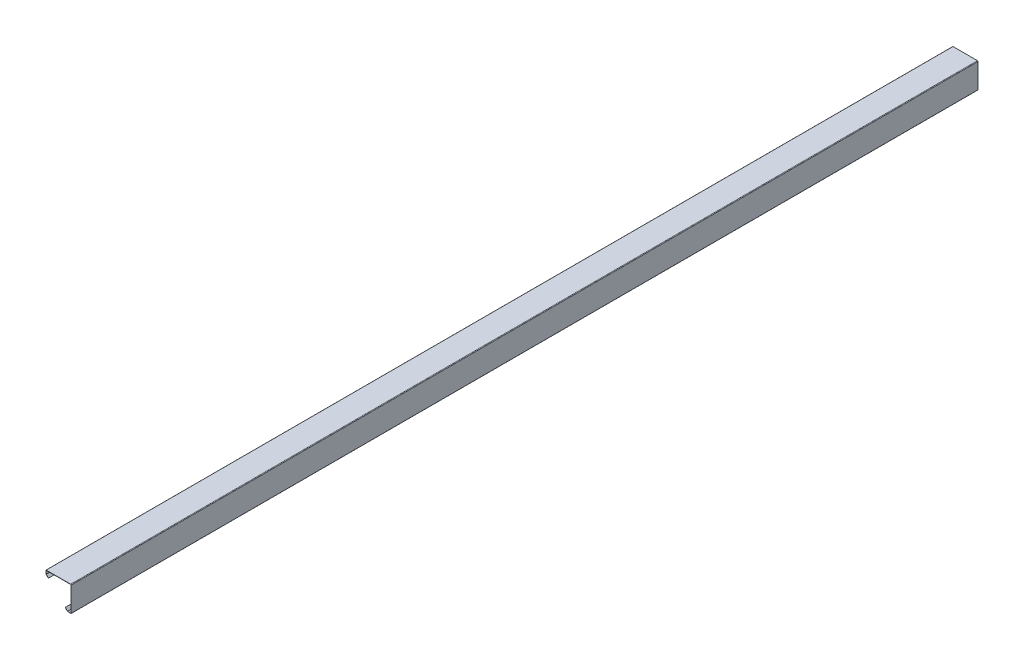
SolidWorks part; units mm, degrees
ref_plane "Front" through (0, 0, 0) normal (0, 0, 1) x (1, 0, 0)
ref_plane "Top" through (0, 0, 0) normal (0, 1, 0) x (1, 0, 0)
ref_plane "Right" through (0, 0, 0) normal (1, 0, 0) x (0, 0, -1)
sketch "Sketch1" plane through (0, 0, 0) normal (0, 0, 1) x (1, 0, 0)
  line L0 (-0.4122, -55.5625) -> (-7.9375, -55.5625)
  line L1 (-8.2289, -55.4418) -> (-13.2803, -50.3904)
  line L2 (-55.1503, 0) -> (-1.27, 0)
  line L3 (-55.4418, -8.2289) -> (-50.3904, -13.2803)
  line L4 (-55.5625, -0.4122) -> (-55.5625, -7.9375)
  line L5 (0, -55.1503) -> (0, -1.27)
  line L6 (0, 0) -> (17.4519, 17.4519) construction
  arc A0 (0, -1.27) -> (-1.27, 0) centre (-1.27, -1.27) ccw
  arc A1 (-7.9375, -55.5625) -> (-8.2289, -55.4418) centre (-7.9375, -55.1503) cw
  arc A2 (-0.4122, -55.5625) -> (0, -55.1503) centre (-0.4122, -55.1503) ccw
  arc A3 (-55.4418, -8.2289) -> (-55.5625, -7.9375) centre (-55.1503, -7.9375) cw
  arc A4 (-55.1503, 0) -> (-55.5625, -0.4122) centre (-55.1503, -0.4122) ccw
  point P12 (-8.1082, -55.5625)
  point P16 (0, -55.5625)
  point P19 (-55.5625, -8.1082)
  point P22 (-55.5625, 0)
  dimension "D5" = 55.5625
  dimension "D3" = 7.1437
  dimension "D2" = 7.9375
  dimension "D4" = 1.27
  dimension "D6" = 0.4122
  dimension "D1" = 45
extrude "Extrude-Thin1" add sketch "Sketch1" along normal blind 2000 thin
sketch "Sketch3" plane through (0, 0, 2000) normal (0, 0, 1) x (1, 0, 0)
  line L0 (-7.8978, -55.0545) -> (-7.8978, -55.5625)
  line L1 (-7.9375, -55.5625) -> (-0.4122, -55.5625) construction
  line L2 (-7.8978, -55.0545) -> (-8.2289, -55.4418)
